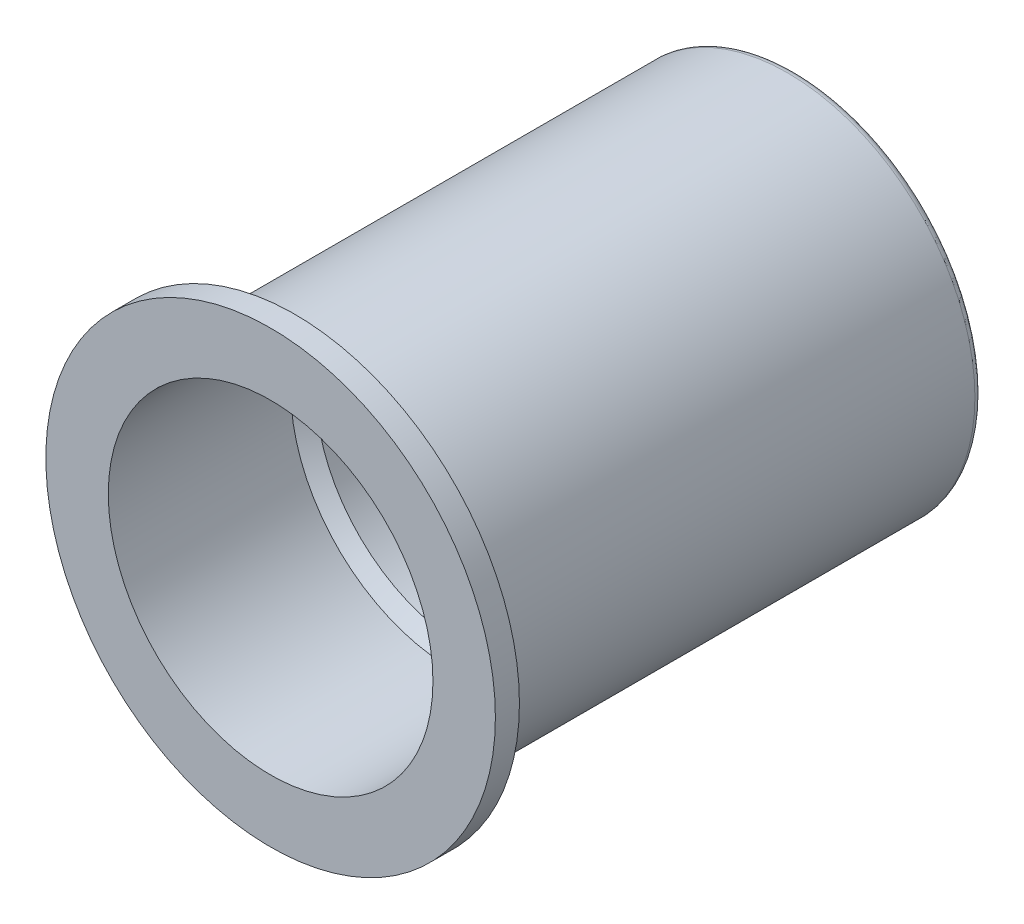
SolidWorks part; units mm, degrees
ref_plane "Front" through (0, 0, 0) normal (0, 0, 1) x (1, 0, 0)
ref_plane "Top" through (0, 0, 0) normal (0, 1, 0) x (1, 0, 0)
ref_plane "Right" through (0, 0, 0) normal (1, 0, 0) x (0, 0, -1)
sketch "Sketch3" plane through (0, 0, 0) normal (0, 0, 1) x (1, 0, 0)
  circle A0 centre (0, 0) radius 9
  dimension "dk" = 18
extrude "BaseHead" add sketch "Sketch3" against normal blind 1.8
sketch "Sketch4" plane through (-3.067, 2.6488, 0) normal (0, 0, -1) x (-1, 0, 0)
  circle A0 centre (-3.067, -2.6488) radius 7.5
  circle A1 centre (-3.067, -2.6488) radius 9 construction
  dimension "d" = 15
extrude "BaseBody" add sketch "Sketch4" along normal blind 21
sketch "Sketch8" plane through (9, 0, 1.1855) normal (0, 1, 0) x (-1, 0, 0)
  line L0 (9, 2.3542) -> (9, -3.5397) construction
  line L2 (18, -2.1483) -> (16.55, -2.9855)
  line L5 (16.55, -2.9855) -> (18, -2.9855)
  line L7 (18, -2.9855) -> (18, -2.1483)
  dimension "D1" = 30
  dimension "D2" = 15.1
revolve "BearingFace" cut sketch "Sketch8" angle 360 about L0
sketch "Sketch5" plane through (1.6426, -1.4193, 0) normal (0, 0, 1) x (1, 0, 0)
  circle A0 centre (-1.6426, 1.4193) radius 6.5
  circle A2 centre (-1.6426, 1.4193) radius 7.5 construction
  dimension "d1" = 13
extrude "Hole1" cut sketch "Sketch5" against normal blind 7.3
sketch "Sketch6" plane through (-0.0097, -0.1511, -7.3) normal (0, 0, 1) x (1, 0, 0)
  circle A0 centre (0.0097, 0.1511) radius 6
  circle A1 centre (0.0097, 0.1511) radius 6.5 construction
  dimension "D1" = 12
extrude "Hole2" cut sketch "Sketch6" against normal through all
fillet "Fillet1" radius 0.3 2 edges at (-7.5, 0, -21) (7.55, 0, -1.8)
chamfer "Chamfer1" distance 0.5 angle 45 1 edges at (6, 0, -7.3)
chamfer "Chamfer2" distance 0.48 angle 45 1 edges at (6, 0, -21)
sketch "Sketch9" plane through (0, 0, 0) normal (0, 1, 0) x (1, 0, 0)
  line L0 (0, 25.2227) -> (0, -4.8181) construction
  line L1 (5.5, 20.77) -> (5.5, 20.27)
  line L2 (5.5, 20.27) -> (6, 20.27)
  line L3 (6, 20.27) -> (6.433, 20.52)
  line L4 (6.433, 20.52) -> (6, 20.77)
  line L5 (6, 20.77) -> (5.5, 20.77)
  line L6 (-6, 20.52) -> (6, 20.52) construction
  dimension "D1" = 12
  dimension "D2" = 0.5
revolve "Cut-Revolve10" [suppressed] cut sketch "Sketch9" angle 360 about L0
pattern_linear "LPattern10" [suppressed] count 22 spacing 0.6 along (0, 0, 1)
equation "\"D2@Sketch8\"=\"d@Sketch4\"+ 0.1"
equation "\"D1@Chamfer1\" =  ( \"d1@Sketch5\" - \"D1@Sketch6\" )  / 2"
equation "\"D1@Chamfer2\" = \"D1@Sketch6\" / 25"
equation "\"D2@Sketch9\" = (  \"D2@ThreadCosmetic1\" - \"D1@Sketch6\" )  / 2"
equation "\"D1@Sketch9\" = \"D1@Sketch6\""
equation "\"D1@LPattern10\" = ( \"l@BaseBody\" -  \"l1@Hole1\" )  / \"D3@LPattern10\" - 1"
equation "\"D3@LPattern10\" = \"D2@Sketch9\" * 1.2"
